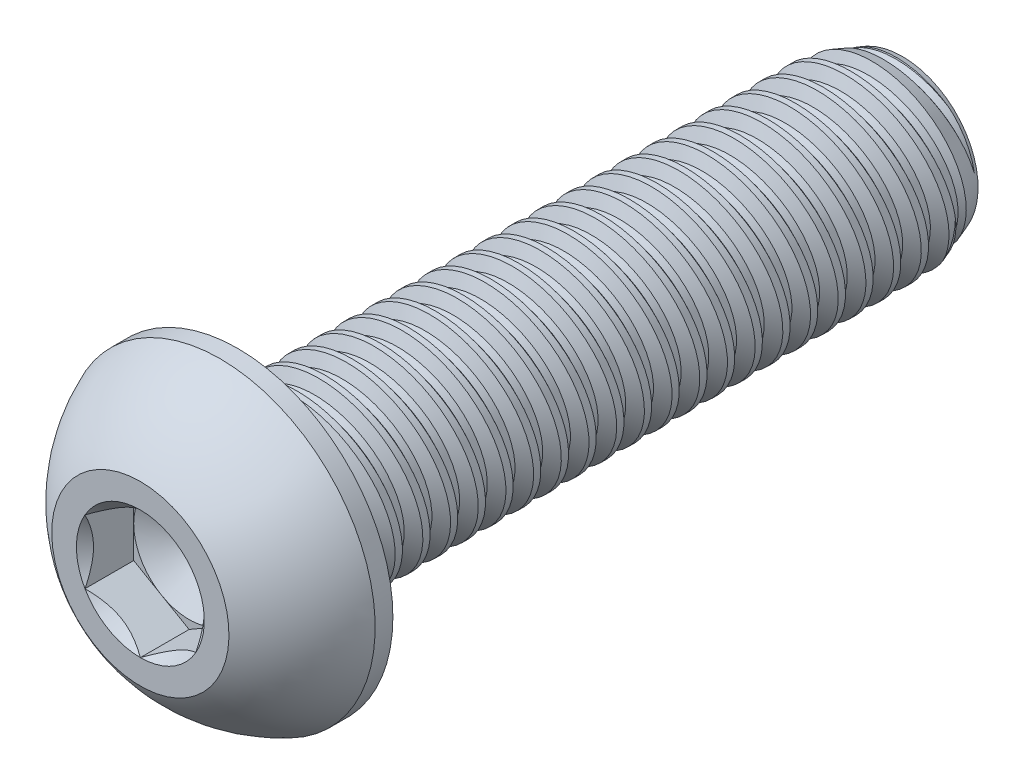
SolidWorks part; units mm, degrees
ref_plane "Front" through (0, 0, 0) normal (0, 0, 1) x (1, 0, 0)
ref_plane "Top" through (0, 0, 0) normal (0, 1, 0) x (1, 0, 0)
ref_plane "Right" through (0, 0, 0) normal (1, 0, 0) x (0, 0, -1)
sketch "Sketch1" plane through (0, 0, 0) normal (1, 0, 0) x (0, 0, -1)
  line L0 (0, 0) -> (-4.4, 0) construction
  line L1 (0, 0) -> (30, 0)
  line L2 (0, 0) -> (0, 4)
  line L3 (0, 4) -> (30, 4)
  line L4 (30, 0) -> (30, 4)
  line L5 (0, -4) -> (30, -4) construction
  dimension "D1" = 30
  dimension "Thread Dia" = 8
  dimension "Length" = 30
  dimension "Head Height" = 4.4
revolve "Revolve1" add sketch "Sketch1" angle 360 about L0
ref_plane "Plane1" through (0, 0, 4.4) normal (0, 0, 1) x (1, 0, 0)
sketch "Sketch2" plane through (0, 0, 0) normal (1, 0, 0) x (0, 0, -1)
  line L0 (0, 4) -> (0, -4) construction
  line L1 (0, -4) -> (1.25, -4) construction
  line L2 (1.25, -4) -> (0, 4) construction
  line L3 (0, 4) -> (0.1544, 4.0241) construction
  line L4 (0.1544, 4.0241) -> (1.235, 4.193)
  line L5 (1.235, 4.193) -> (0.9535, 3.4642)
  line L6 (0.9535, 3.4642) -> (0.6448, 3.416)
  line L7 (0.6448, 3.416) -> (0.1544, 4.0241)
  line L8 (0.7991, 3.4401) -> (0.6947, 4.1085) construction
  line L9 (0, -4) -> (30, -4) construction
  line L10 (0, 4) -> (30, 4) construction
  line L12 (0.7117, 4) -> (1.9617, -4) construction
  line L13 (0, -0.2089) -> (2.6733, 0.2089) construction
  line L15 (0, 0) -> (0, 4) construction
  point P19 (1.3367, 0)
  dimension "D1" = 60
  dimension "Thread Pitch" = 1.25
  dimension "D2" = 0.1562
  dimension "D3" = 0.3125
  dimension "D4" = 1.25
revolve "Cut-Revolve1" cut sketch "Sketch2" angle 360 about L13
sketch "Sketch3" plane through (0, 0, 0) normal (1, 0, 0) x (0, 0, -1)
  line L0 (30, 3.416) -> (28.3953, 4)
  line L1 (28.3953, 4) -> (30, 4)
  line L2 (30, 4) -> (30, 3.416)
  line L3 (0, 4) -> (30, 4) construction
  line L4 (30, 0) -> (30, 4) construction
  line L5 (28.3953, 0) -> (0, 0) construction
  line L6 (28.3953, 4) -> (28.3953, -4) construction
  line L7 (0, -4) -> (30, -4) construction
  dimension "D1" = 20
  dimension "D2" = 8
revolve "Cut-Revolve2" cut sketch "Sketch3" angle 360 about L5
pattern_linear "LPattern1" count 24 spacing 1.25 along (0, 0, 1)
pattern_linear "LPattern2" count 2 spacing 1.25 along (0, 0, 1)
sketch "Sketch4" plane through (0, 0, 0) normal (0, 0, 1) x (1, 0, 0)
  circle A0 centre (0, 0) radius 7
  dimension "Head Dia" = 14
extrude "Extrude1" add sketch "Sketch4" along normal up to surface (4.4 mm away)
sketch "Sketch9" plane through (0, 0, 0) normal (1, 0, 0) x (0, 0, -1)
  line L0 (0, 7) -> (-0.8, 7)
  line L1 (-4.4, 4) -> (-5.2, 4)
  line L2 (-5.2, 4) -> (-5.2, 7.8)
  line L3 (0, 0) -> (-4.4, 0) construction
  line L4 (-5.2, 7.8) -> (0, 7.8)
  line L5 (0, 7.8) -> (0, 7)
  line L6 (0, 0) -> (0, 4) construction
  line L10 (0, 7) -> (-4.4, 7) construction
  line L11 (0, 4) -> (30, 4) construction
  line L12 (-4.4, 7) -> (-4.4, -7) construction
  arc A0 (-0.8, 7) -> (-4.4, 4) centre (1.9833, 0) ccw
  dimension "Head Side Height" = 0.8
revolve "Cut-Revolve3" cut sketch "Sketch9" angle 360 about L3
sketch "Sketch6" plane through (0, 0, 4.4) normal (0, 0, 1) x (1, 0, 0)
  line L1 (0, -2.8868) -> (2.5, -1.4434)
  line L2 (2.5, -1.4434) -> (2.5, 1.4434)
  line L3 (2.5, 1.4434) -> (0, 2.8868)
  line L4 (0, 2.8868) -> (-2.5, 1.4434)
  line L5 (-2.5, 1.4434) -> (-2.5, -1.4434)
  line L6 (-2.5, -1.4434) -> (0, -2.8868)
  circle A0 centre (0, 0) radius 2.5 construction
  dimension "Hex" = 5
extrude "Cut-Extrude1" cut sketch "Sketch6" against normal blind 2.2
sketch "Sketch7" plane through (0, 0, 4.4) normal (0, 0, 1) x (1, 0, 0)
  circle A0 centre (0, 0) radius 2.8868
extrude "Cut-Extrude4" cut sketch "Sketch7" against normal blind 2.2 draft 45
sketch "Sketch8" plane through (0, 0, 2.2) normal (0, 0, 1) x (1, 0, 0)
  circle A0 centre (0, 0) radius 2.5 construction
  circle A1 centre (0, 0) radius 2.5
extrude "Cut-Extrude5" cut sketch "Sketch8" against normal blind 0.7333 draft 60
equation "\"D2@Sketch2\"=\"Thread Pitch@Sketch2\"/8"
equation "\"D3@Sketch2\"=\"Thread Pitch@Sketch2\"/4"
equation "\"D4@Sketch2\"=\"Thread Pitch@Sketch2\""
equation "\"D3@LPattern1\"=\"Thread Pitch@Sketch2\""
equation "\"D1@Cut-Extrude1\"=\"Head Height@Sketch1\"/2"
equation "\"D1@Cut-Extrude4\"=\"D1@Cut-Extrude1\""
equation "\"D1@Cut-Extrude5\"=\"D1@Cut-Extrude1\"/3"
equation "\"D1@LPattern1\"=\"D1@Sketch1\"/\"Thread Pitch@Sketch2\""
equation "\"D3@LPattern2\"=\"Thread Pitch@Sketch2\""
